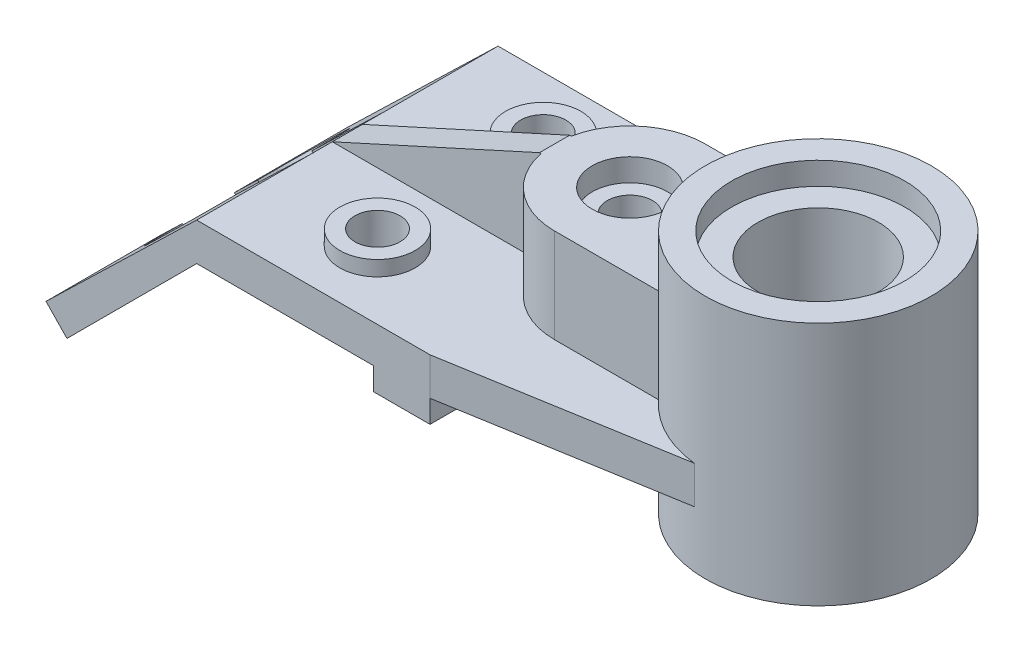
SolidWorks part; units mm, degrees
ref_plane "Front Plane" through (0, 0, 0) normal (0, 0, 1) x (1, 0, 0)
ref_plane "Top Plane" through (0, 0, 0) normal (0, 1, 0) x (1, 0, 0)
ref_plane "Right Plane" through (0, 0, 0) normal (1, 0, 0) x (0, 0, -1)
sketch "Sketch2" plane through (0, 0, 0) normal (0, 1, 0) x (1, 0, 0)
  line L0 (-8.52, 39.0718) -> (-8.52, -30.8595) construction
  circle A2 centre (-8.52, 5.2914) radius 30
  dimension "D1" = 60
extrude "Boss-Extrude2" add sketch "Sketch2" along normal blind 65
sketch "Sketch4" plane through (0, 65, 0) normal (0, 1, 0) x (1, 0, 0)
  circle A0 centre (-8.52, 5.2914) radius 23
  dimension "D1" = 46
extrude "Cut-Extrude1" cut sketch "Sketch4" against normal blind 6
sketch "Sketch5" plane through (0, 59, 0) normal (0, 1, 0) x (1, 0, 0)
  circle A0 centre (-8.52, 5.2914) radius 16
  dimension "D1" = 32
extrude "Cut-Extrude2" cut sketch "Sketch5" against normal blind 110
ref_plane "Plane2" through (0, 15, 0) normal (0, 1, 0) x (1, 0, 0)
sketch "Sketch11" plane through (0, 15, 0) normal (0, 1, 0) x (1, 0, 0)
  line L0 (-11.5733, 35.1356) -> (-71.5733, 45.2914)
  line L1 (-71.5733, 45.2914) -> (-133.52, 45.2914)
  line L2 (-133.52, 45.2914) -> (-133.52, -34.7086)
  line L5 (-133.52, -34.7086) -> (-71.5733, -34.7086)
  line L6 (-71.5733, -34.7086) -> (-11.5733, -24.5528)
  line L7 (-8.52, 5.2914) -> (-215.397, 5.2914) construction
  circle A0 centre (-8.52, 5.2914) radius 30 construction
  arc A1 (-11.5733, -24.5528) -> (-11.5733, 35.1356) centre (-8.52, 5.2914) cw
  point P5 (0, 0)
  dimension "D1" = 30
  dimension "D2" = 60
  dimension "D3" = 40
  dimension "D4" = 125
  dimension "D5" = 40
  dimension "D6" = 60
extrude "Boss-Extrude4" add sketch "Sketch11" along normal blind 10
sketch "Sketch12" plane through (0, 25, 0) normal (0, 1, 0) x (1, 0, 0)
  line L0 (-58.52, 25.2914) -> (-30.8806, 25.2914)
  line L1 (-58.52, -14.7086) -> (-30.8806, -14.7086)
  line L2 (-30.8806, -14.7086) -> (-30.8806, 25.2914)
  line L3 (-8.52, 5.2914) -> (-166.0912, 5.2914) construction
  arc A3 (-11.5733, 35.1356) -> (-11.5733, -24.5528) centre (-8.52, 5.2914) ccw construction
  arc A5 (-58.52, 25.2914) -> (-58.52, -14.7086) centre (-58.52, 5.2914) ccw
  dimension "D1" = 20
  dimension "D2" = 50
extrude "Boss-Extrude5" add sketch "Sketch12" along normal blind 25
sketch "Sketch13" plane through (0, 50, 0) normal (0, 1, 0) x (1, 0, 0)
  line L0 (-58.52, 24.076) -> (-58.52, -14.7086) construction
  circle A0 centre (-58.52, 5.2914) radius 10
  dimension "D1" = 20
extrude "Cut-Extrude3" cut sketch "Sketch13" against normal blind 6
sketch "Sketch14" plane through (0, 44, 0) normal (0, 1, 0) x (1, 0, 0)
  circle A0 centre (-58.52, 5.2914) radius 6
  dimension "D1" = 12
extrude "Cut-Extrude4" cut sketch "Sketch14" against normal blind 35
sketch "Sketch15" plane through (0, 25, 0) normal (0, 1, 0) x (1, 0, 0)
  line L0 (-8.52, 5.2914) -> (-157.631, 5.2914) construction
  line L1 (-103.52, 27.2914) -> (-103.52, -44.6189) construction
  line L2 (-103.52, 43.9425) -> (-103.52, -32.312) construction
  circle A0 centre (-103.52, 27.2914) radius 10
  circle A1 centre (-103.52, -16.7086) radius 10
  dimension "D1" = 20
  dimension "D2" = 20
  dimension "D3" = 22
  dimension "D4" = 22
  dimension "D5" = 95
extrude "Boss-Extrude6" add sketch "Sketch15" along normal blind 4
sketch "Sketch16" plane through (0, 29, 0) normal (0, 1, 0) x (1, 0, 0)
  circle A0 centre (-103.52, 27.2914) radius 6
  dimension "D1" = 12
extrude "Cut-Extrude5" cut sketch "Sketch16" against normal blind 24
sketch "Sketch17" plane through (0, 29, 0) normal (0, 1, 0) x (1, 0, 0)
  circle A0 centre (-103.52, -16.7086) radius 6
  dimension "D1" = 12
extrude "Cut-Extrude6" cut sketch "Sketch17" against normal blind 24
ref_plane "Plane3" through (0, 0, -5.2914) normal (0, 0, 1) x (1, 0, 0)
sketch "Sketch22" plane through (0, 0, -5.2914) normal (0, 0, 1) x (1, 0, 0)
  line L0 (-133.52, 25) -> (-78.52, 50)
  line L1 (-78.52, 50) -> (-68.52, 50)
  line L2 (-58.52, 50) -> (-78.52, 50) construction
  line L3 (-68.52, 50) -> (-68.52, 25)
  line L4 (-68.52, 25) -> (-133.52, 25)
extrude "Boss-Extrude10" add sketch "Sketch22" along normal blind 4 and the other way blind 4
sketch "Sketch24" plane through (0, 0, 34.7086) normal (0, 0, 1) x (1, 0, 0)
  line L0 (-133.52, 25) -> (-173.52, -13.6879)
  line L1 (-173.52, -13.6879) -> (-167.9582, -19.4382)
  line L2 (-167.9582, -19.4382) -> (-133.52, 15)
  line L3 (-133.52, 15) -> (-133.52, 25)
  line L4 (-133.52, 15) -> (-71.5733, 15) construction
  dimension "D1" = 135
  dimension "D2" = 8
  dimension "D3" = 40
extrude "Boss-Extrude11" add sketch "Sketch24" against normal blind 80
sketch "Sketch25" plane through (-77.0272, 79.6396, 0) normal (-0.6952, 0.7188, 0) x (0.7188, 0.6952, 0)
  line L0 (-115.6065, 20.2914) -> (-115.6065, -9.7086) construction
  line L1 (-105.6065, 20.2914) -> (-105.6065, -9.7086)
  line L2 (-125.6065, 20.2914) -> (-125.6065, -9.7086)
  line L4 (-78.5934, -34.7086) -> (-134.2419, -34.7086) construction
  arc A0 (-105.6065, 20.2914) -> (-125.6065, 20.2914) centre (-115.6065, 20.2914) ccw
  arc A1 (-125.6065, -9.7086) -> (-105.6065, -9.7086) centre (-115.6065, -9.7086) ccw
  point P2 (-115.6065, 5.2914)
  point P7 (0, 0)
  point P8 (0, 0)
  dimension "D1" = 10
  dimension "D2" = 30
  dimension "D3" = 25
extrude "Cut-Extrude7" cut sketch "Sketch25" against normal blind 80
sketch "Sketch26" plane through (-77.0272, 79.6396, 0) normal (-0.6952, 0.7188, 0) x (0.7188, 0.6952, 0)
  line L0 (-134.2419, 45.2914) -> (-134.2419, -34.7086) construction
  line L1 (-78.893, 15.2914) -> (-134.2419, 15.2914)
  line L2 (-78.893, 15.2914) -> (-78.893, -4.7086)
  line L3 (-78.893, -4.7086) -> (-134.2419, -4.7086)
  line L4 (-134.2419, 15.2914) -> (-134.2419, -4.7086)
  dimension "D1" = 20
  dimension "D2" = 30
extrude "Cut-Extrude8" cut sketch "Sketch26" against normal blind 2
sketch "Sketch28" plane through (0, 0, 34.7086) normal (0, 0, 1) x (1, 0, 0)
  line L0 (-71.5733, 15) -> (-71.5733, 9)
  line L1 (-71.5733, 25) -> (-71.5733, 15) construction
  line L2 (54.3877, 15) -> (-54.3877, 15) construction
  line L3 (-71.5733, 9) -> (-86.5733, 9)
  line L4 (-86.5733, 9) -> (-86.5733, 15)
  line L5 (-86.5733, 15) -> (-71.5733, 15)
  dimension "D1" = 15
  dimension "D2" = 6
extrude "Boss-Extrude14" add sketch "Sketch28" against normal blind 80
